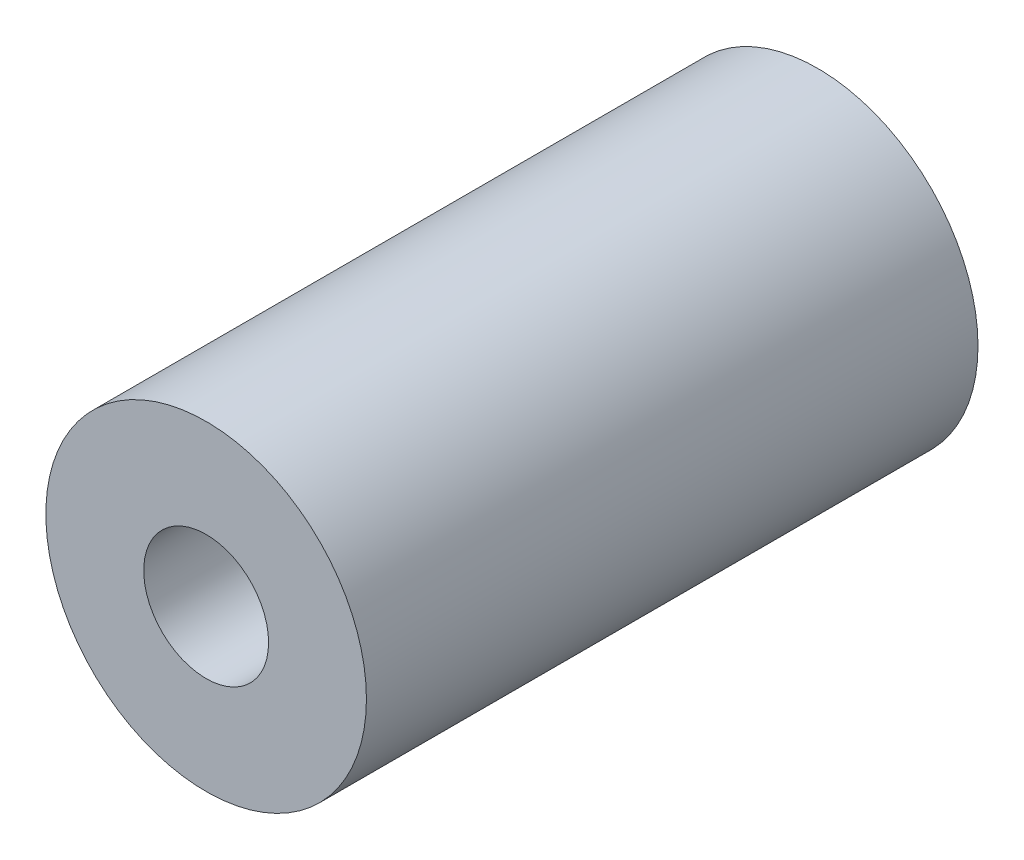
SolidWorks part; units mm, degrees
ref_plane "Front Plane" through (0, 0, 0) normal (0, 0, 1) x (1, 0, 0)
ref_plane "Top Plane" through (0, 0, 0) normal (0, 1, 0) x (1, 0, 0)
ref_plane "Right Plane" through (0, 0, 0) normal (1, 0, 0) x (0, 0, -1)
sketch "Sketch1" plane through (0, 0, 0) normal (0, 0, 1) x (1, 0, 0)
  circle A0 centre (0, 0) radius 2.5527
  circle A1 centre (0, 0) radius 6.5527
  dimension "D1" = 5.1054
  dimension "D2" = 4
extrude "Boss-Extrude1" add sketch "Sketch1" along normal mid plane 25
